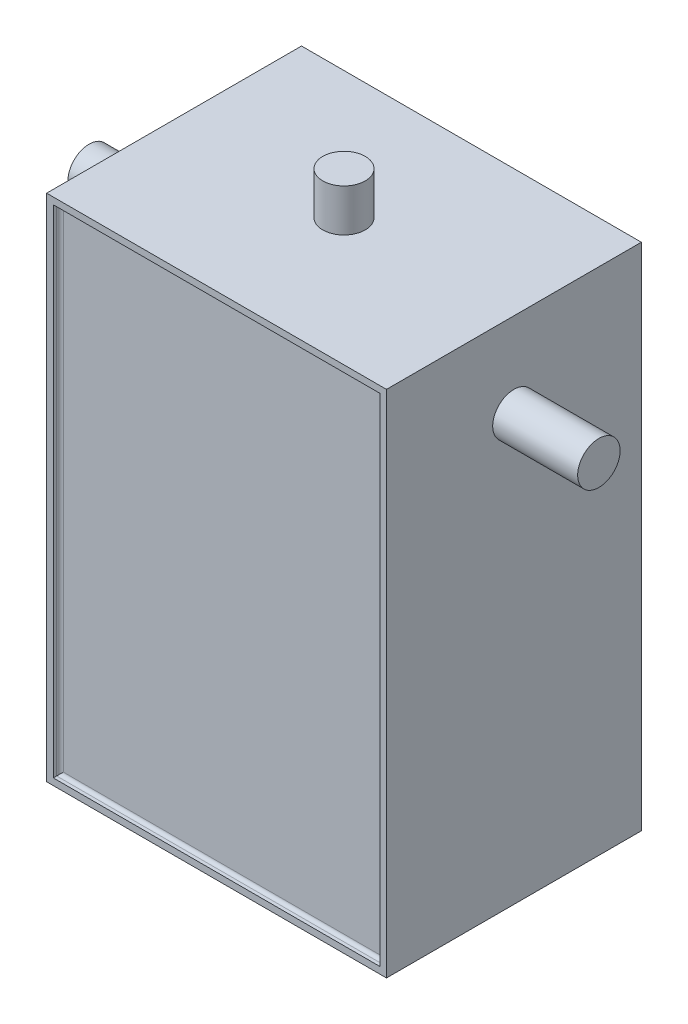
SolidWorks part; units mm, degrees
ref_plane "Front Plane" through (0, 0, 0) normal (0, 0, 1) x (1, 0, 0)
ref_plane "Top Plane" through (0, 0, 0) normal (0, 1, 0) x (1, 0, 0)
ref_plane "Right Plane" through (0, 0, 0) normal (1, 0, 0) x (0, 0, -1)
sketch "Sketch1" plane through (0, 0, 0) normal (0, 0, 1) x (1, 0, 0)
  line L1 (0, 0) -> (101.6, 0)
  line L2 (0, 0) -> (0, 152.4)
  line L3 (0, 152.4) -> (101.6, 152.4)
  line L4 (101.6, 0) -> (101.6, 152.4)
  dimension "D1" = 152.4
  dimension "D2" = 101.6
extrude "Boss-Extrude1" add sketch "Sketch1" against normal blind 76.2
sketch "Sketch2" plane through (101.6, 0, 0) normal (1, 0, 0) x (0, 0, -1)
  line L0 (76.2, 152.4) -> (0, 152.4) construction
  circle A0 centre (38.1, 127) radius 6.35
  dimension "D2" = 12.7
  dimension "D1" = 25.4
extrude "Boss-Extrude2" add sketch "Sketch2" along normal blind 25.4
pattern_linear "LPattern1" count 2 spacing 127 along (-1, 0, 0) of "Boss-Extrude2"
sketch "Sketch3" plane through (0, 0, 0) normal (0, -1, 0) x (1, 0, 0)
  line L0 (0, -76.2) -> (0, 0) construction
  circle A0 centre (50.8, -38.1) radius 12.7
  point P4 (0, -38.1)
  dimension "D2" = 25.4
  dimension "D1" = 0
extrude "Boss-Extrude3" add sketch "Sketch3" along normal blind 12.7
sketch "Sketch4" plane through (0, 0, 0) normal (0, 0, 1) x (1, 0, 0)
  line L8 (2, 150.4) -> (2, 2)
  line L9 (2, 2) -> (99.6, 2)
  line L10 (99.6, 2) -> (99.6, 150.4)
  line L11 (99.6, 150.4) -> (2, 150.4)
  line L12 (2, 150.4) -> (2, 2)
  line L13 (2, 2) -> (99.6, 2)
  line L14 (99.6, 2) -> (99.6, 150.4)
  line L15 (99.6, 150.4) -> (2, 150.4)
  dimension "D1" = 2
extrude "Cut-Extrude1" cut sketch "Sketch4" against normal blind 2
fillet "Fillet1" radius 1 4 edges at (50.8, 2, -2) (2, 76.2, -2) (99.6, 76.2, -2) (50.8, 150.4, -2)
ref_plane "Plane1" through (0, 0, -38.1) normal (0, 0, 1) x (1, 0, 0)
mirror "Mirror1" about plane through (0, 0, -38.1) normal (0, 0, 1) of "Fillet1", "Cut-Extrude1"
sketch "Sketch5" plane through (0, 152.4, 0) normal (0, 1, 0) x (1, 0, 0)
  line L0 (50.8, 76.2) -> (50.8, 0)
  line L6 (0, 0) -> (101.6, 0)
  line L7 (101.6, 0) -> (101.6, 76.2)
  line L8 (101.6, 76.2) -> (0, 76.2)
  line L9 (0, 76.2) -> (0, 0)
  line L10 (0, 0) -> (101.6, 0)
  line L11 (101.6, 0) -> (101.6, 76.2)
  line L12 (101.6, 76.2) -> (0, 76.2)
  line L13 (0, 76.2) -> (0, 0)
  circle A0 centre (50.8, 38.1) radius 6.35
  dimension "D2" = 12.7
  dimension "D1" = 0
extrude "Boss-Extrude4" add sketch "Sketch5" along normal blind 12.7 contours L0 A0 | L0 A0
